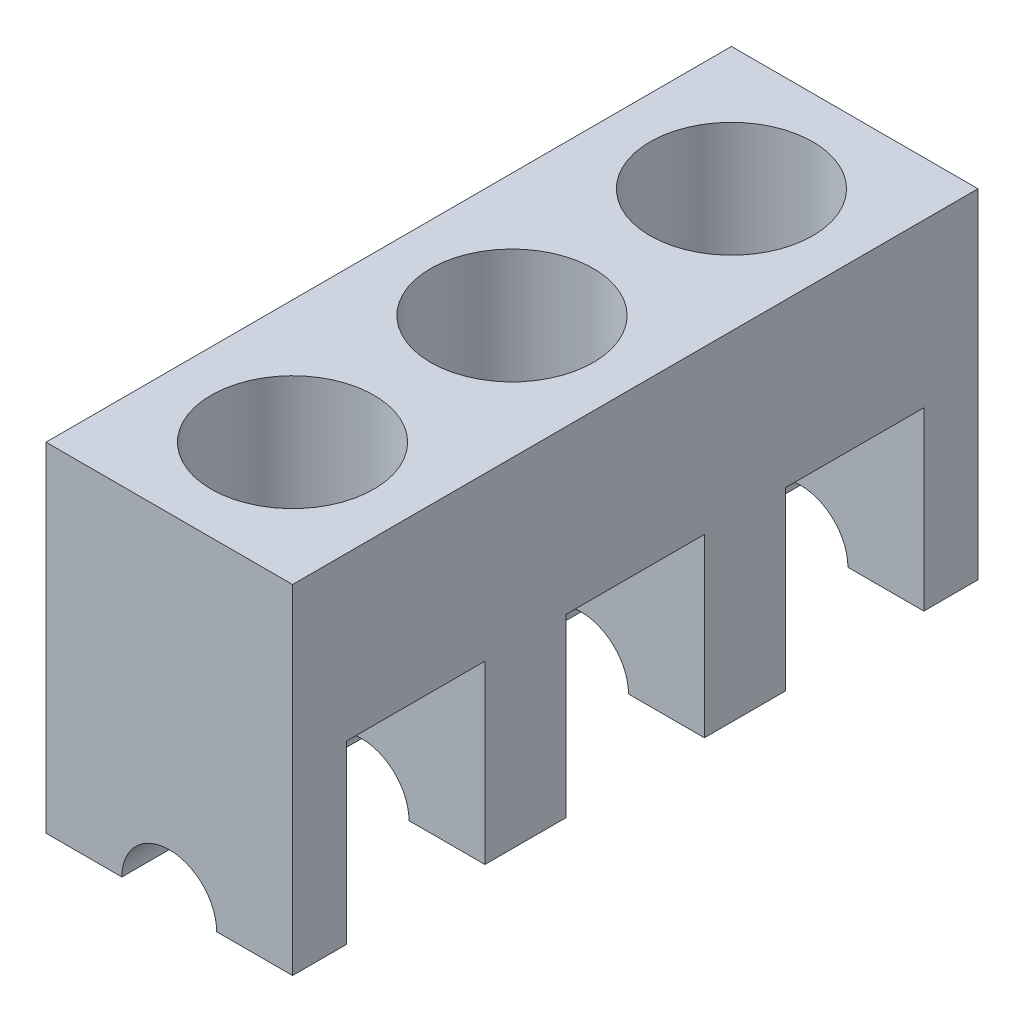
SolidWorks part; units mm, degrees
ref_plane "Front Plane" through (0, 0, 0) normal (0, 0, 1) x (1, 0, 0)
ref_plane "Top Plane" through (0, 0, 0) normal (0, 1, 0) x (1, 0, 0)
ref_plane "Right Plane" through (0, 0, 0) normal (1, 0, 0) x (0, 0, -1)
sketch "Sketch2" plane through (0, 0, 0) normal (1, 0, 0) x (0, 0, -1)
  line L0 (0, 0) -> (0, 125)
  line L1 (0, 125) -> (253, 125)
  line L2 (253, 125) -> (253, 0)
  line L3 (253, 0) -> (233, 0)
  line L4 (233, 0) -> (233, 65)
  line L5 (233, 65) -> (182, 65)
  line L6 (182, 65) -> (182, 0)
  line L7 (182, 0) -> (152, 0)
  line L8 (152, 0) -> (152, 65)
  line L9 (152, 65) -> (101, 65)
  line L10 (101, 65) -> (101, 0)
  line L11 (101, 0) -> (71, 0)
  line L12 (71, 0) -> (71, 65)
  line L13 (71, 65) -> (20, 65)
  line L14 (20, 65) -> (20, 0)
  line L15 (20, 0) -> (0, 0)
  dimension "D1" = 51
  dimension "D2" = 20
  dimension "D3" = 30
  dimension "D4" = 125
  dimension "D5" = 65
extrude "Boss-Extrude1" add sketch "Sketch2" along normal mid plane 91
sketch "Sketch3" plane through (0, 125, 0) normal (0, 1, 0) x (1, 0, 0)
  line L0 (0, -747) -> (0, 49253) construction
  line L1 (45.5, 253) -> (-45.5, 253) construction
  circle A0 centre (0, 207.5) radius 30.05
  circle A1 centre (0, 126.5) radius 30.05
  circle A2 centre (0, 45.5) radius 30.05
  point P5 (0, 253)
  point P13 (36.7616, 14.1442)
  dimension "D1" = 81
  dimension "D4" = 60.1
  dimension "D2" = 81
  dimension "D3" = 45.5
extrude "Cut-Extrude1" cut sketch "Sketch3" against normal blind 81
sketch "Sketch4" plane through (0, 0, 0) normal (0, 0, 1) x (1, 0, 0)
  circle A0 centre (0, 0) radius 17.5
  dimension "D1" = 35
extrude "Cut-Extrude2" cut sketch "Sketch4" against normal through all
